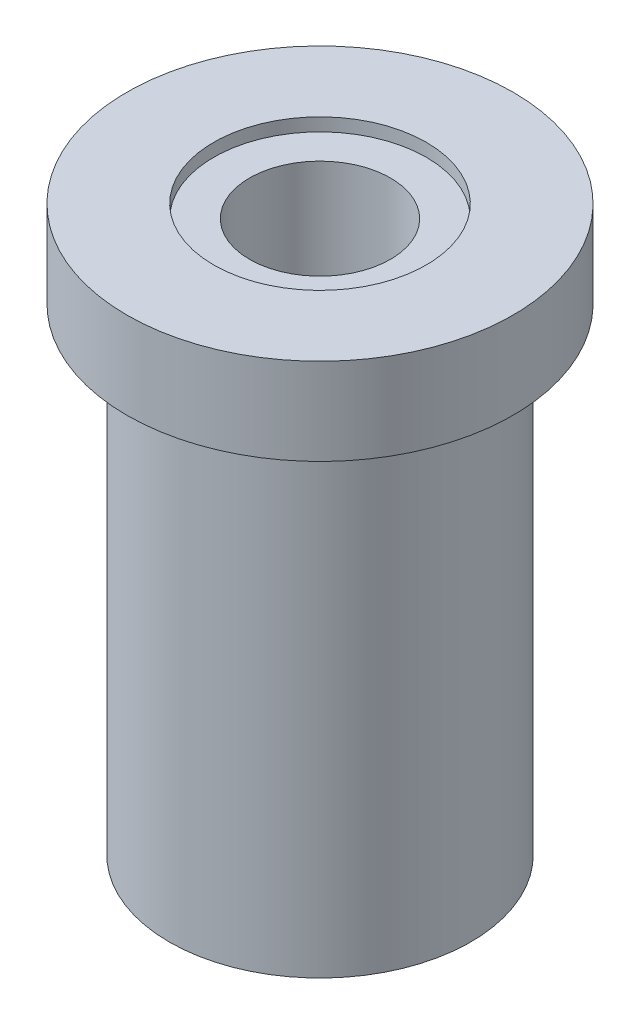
SolidWorks part; units mm, degrees
ref_plane "Přední rovina" through (0, 0, 0) normal (0, 0, 1) x (1, 0, 0)
ref_plane "Horní rovina" through (0, 0, 0) normal (0, 1, 0) x (1, 0, 0)
ref_plane "Pravá rovina" through (0, 0, 0) normal (1, 0, 0) x (0, 0, -1)
sketch "Skica1" plane through (0, 0, 0) normal (0, 1, 0) x (1, 0, 0)
  circle A0 centre (0, 0) radius 6.95
  dimension "D1" = 13.9
extrude "Přidat vysunutím1" add sketch "Skica1" along normal blind 22
sketch "Skica2" plane through (0, 22, 0) normal (0, 1, 0) x (-1, 0, 0)
  circle A0 centre (0, 0) radius 8.9
  dimension "D1" = 17.8
extrude "Přidat vysunutím2" add sketch "Skica2" along normal blind 4
fillet "Zaoblit1" radius 0.3 1 edges at (0, 22, 6.95)
sketch "Skica3" plane through (0, 26, 0) normal (0, 1, 0) x (1, 0, 0)
  circle A0 centre (0, 0) radius 3.25
  dimension "D1" = 6.5
extrude "Odebrat vysunutím1" cut sketch "Skica3" against normal through all
sketch "Skica4" plane through (0, 26, 0) normal (0, 1, 0) x (1, 0, 0)
  circle A0 centre (0, 0) radius 4.9
  dimension "D1" = 9.8
extrude "Odebrat vysunutím2" cut sketch "Skica4" against normal blind 0.6
